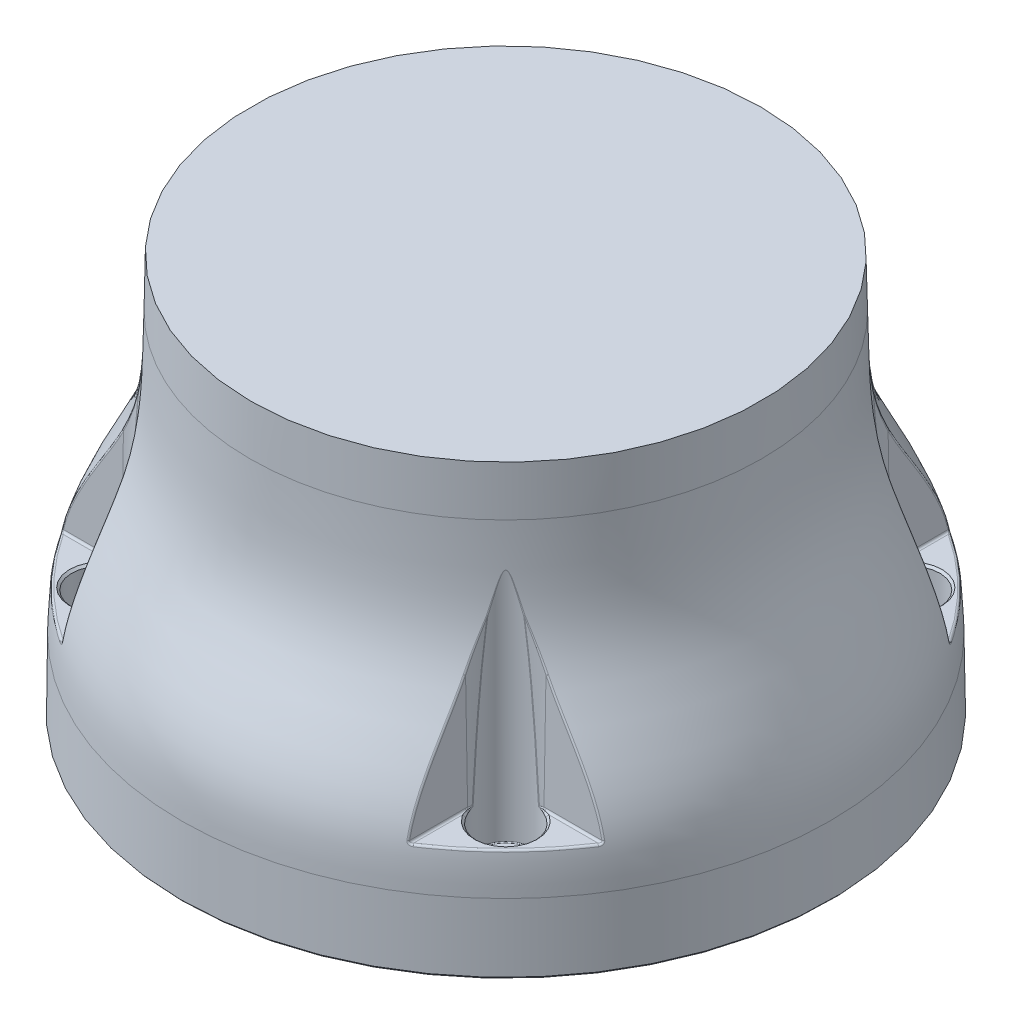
SolidWorks part; units mm, degrees
ref_plane "前视基准面" through (0, 0, 0) normal (0, 0, 1) x (1, 0, 0)
ref_plane "上视基准面" through (0, 0, 0) normal (0, 1, 0) x (1, 0, 0)
ref_plane "右视基准面" through (0, 0, 0) normal (1, 0, 0) x (0, 0, -1)
imported_body "输入1"
sketch "草图1" plane through (0, 84.4, 0) normal (0, 1, 0) x (1, 0, 0)
  circle A0 centre (0, 0) radius 57 construction
  circle A1 centre (0, 0) radius 57
extrude "凸台-拉伸1" add sketch "草图1" along normal up to surface (7.5 mm away)
